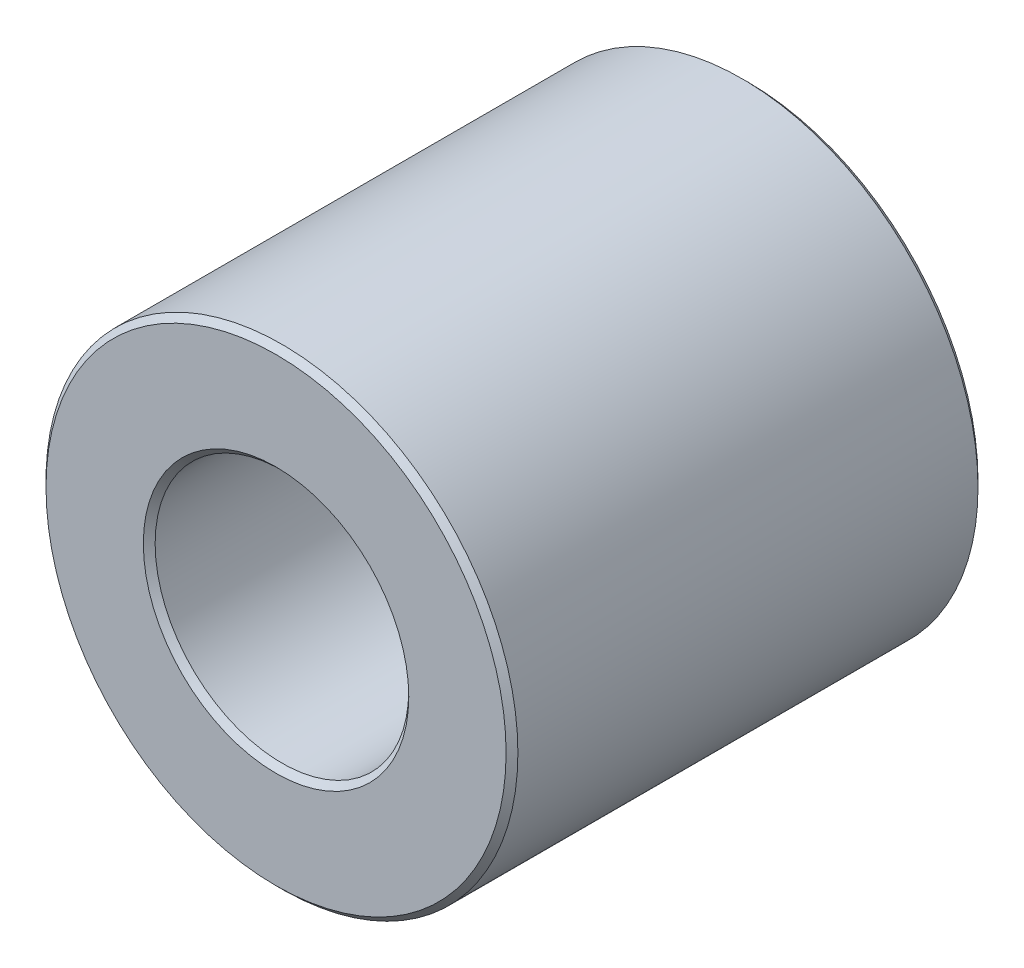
SolidWorks part; units mm, degrees
ref_plane "Front Plane" through (0, 0, 0) normal (0, 0, 1) x (1, 0, 0)
ref_plane "Top Plane" through (0, 0, 0) normal (0, 1, 0) x (1, 0, 0)
ref_plane "Right Plane" through (0, 0, 0) normal (1, 0, 0) x (0, 0, -1)
sketch "Sketch1" plane through (0, 0, 0) normal (0, 0, 1) x (1, 0, 0)
  circle A0 centre (0, 0) radius 4
  circle A1 centre (0, 0) radius 2.15
  dimension "D1" = 8
  dimension "D2" = 4.3
extrude "Boss-Extrude2" add sketch "Sketch1" along normal mid plane 8
chamfer "Chamfer3" distance 0.1 angle 45 4 edges at (4, 0, 4) (4, 0, -4) (2.15, 0, -4) (2.15, 0, 4)
